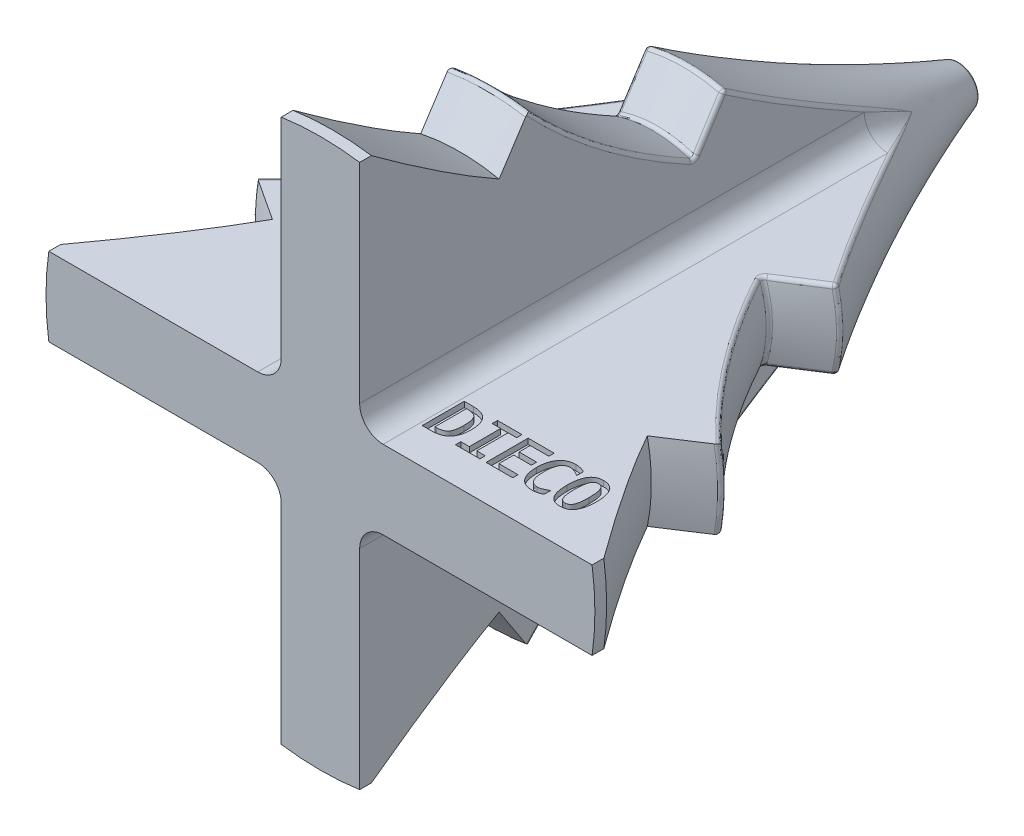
SolidWorks part; units mm, degrees
ref_plane "Alzado" through (0, 0, 0) normal (0, 0, 1) x (1, 0, 0)
ref_plane "Planta" through (0, 0, 0) normal (0, 1, 0) x (1, 0, 0)
ref_plane "Vista lateral" through (0, 0, 0) normal (1, 0, 0) x (0, 0, -1)
sketch "Croquis1" plane through (0, 0, 0) normal (0, 1, 0) x (1, 0, 0)
  line L0 (0, 0) -> (0, 80)
  line L1 (0, 0) -> (35, 0)
  line L2 (0, 80) -> (0, 45) construction
  line L3 (0, 80) -> (2.5, 80)
  line L4 (0, 45) -> (0, 20) construction
  line L10 (14.323, 41.2154) -> (20, 45)
  line L11 (24.4232, 16.2821) -> (30, 20)
  spline S0 degree 2 poles (2.5, 80) (9.2645, 61.0905) (20, 45) knots 0 0 0 0.406484 0.406484 0.406484
  spline S1 degree 3 poles (14.323, 41.2154) (18.5439, 32.9435) (23.7695, 25.8717) (30, 20) knots 0.050771 0.050771 0.050771 0.050771 0.390886 0.390886 0.390886 0.390886
  spline S2 degree 3 poles (24.4232, 16.2821) (26.9964, 11.6094) (30.522, 6.182) (35, 0) knots 0.065396 0.065396 0.065396 0.065396 0.300914 0.300914 0.300914 0.300914
  dimension "D1" = 80
  dimension "D2" = 35
  dimension "D3" = 30
  dimension "D4" = 20
  dimension "D5" = 2.5
revolve "Revolución3" add sketch "Croquis1" angle 360 about L0
sketch "Croquis4" plane through (0, 0, 0) normal (0, 0, 1) x (1, 0, 0)
  line L0 (5, 0) -> (0, 0) construction
  line L1 (0, -5) -> (0, 5) construction
  line L2 (5, -34.641) -> (5, -5)
  line L3 (34.641, 5) -> (5, 5)
  line L4 (-5, -34.641) -> (-5, -5)
  line L5 (34.641, -5) -> (5, -5)
  line L6 (-5, -42.1055) -> (-5, 58.1139) construction
  line L7 (0, -42.1055) -> (0, 58.1139) construction
  line L8 (49.5534, 5) -> (-46.4654, 5) construction
  line L9 (49.5534, 0) -> (-46.4654, 0) construction
  line L10 (49.5534, -5) -> (-46.4654, -5) construction
  line L11 (5, -42.1055) -> (5, 58.1139) construction
  line L12 (-5, 5) -> (-34.641, 5)
  line L14 (-5, 5) -> (-5, 34.641)
  line L15 (-5, -5) -> (-34.641, -5)
  line L16 (5, 5) -> (5, 34.641)
  arc A0 (-5, 34.641) -> (-34.641, 5) centre (0, 0) ccw
  arc A1 (-34.641, -5) -> (-5, -34.641) centre (0, 0) ccw
  arc A2 (5, -34.641) -> (34.641, -5) centre (0, 0) ccw
  arc A3 (34.641, 5) -> (5, 34.641) centre (0, 0) ccw
  dimension "D1" = 5
  dimension "D2" = 5
extrude "Cortar-Extruir5" cut sketch "Croquis4" against normal blind 106
fillet "Redondeo2" radius 0.5 13 edges at (5, 10.3093, -59.4433) (-5, 12.8607, -55.1172) (-10.3093, 5, -59.4433) (-12.8607, -5, -55.1172) (-5, -10.3093, -59.4433) (5, -12.8607, -55.1172) (10.3093, -5, -59.4433) (12.8607, 5, -55.1172) (0, 20, -45) (-20, 0, -45) (0, -20, -45) (20, 0, -45) (2.5, 0, -80)
sketch "Croquis5" plane through (0, 5, 0) normal (0, 1, 0) x (1, 0, 0)
  line L0 (7.9387, 3.0649) -> (36.7751, 3.0649) construction
  text T0 "<b>DIECO</b>" font "DejaVu Sans Mono" height in points 20
extrude "Cortar-Extruir6" cut sketch "Croquis5" against normal blind 0.7
fillet "Redondeo3" radius 3 8 edges at (-4.9195, 4.9195, -68.7593) (-4.9195, -4.9195, -68.7593) (4.9195, -4.9195, -68.7593) (4.9195, 4.9195, -68.7593) (-5, 5, -34.0503) (-5, -5, -34.0503) (5, -5, -34.0503) (5, 5, -34.0503)
fillet "Redondeo5" radius 0.5 32 edges at (-4.9192, 19.1756, -45.0362) (4.9192, 19.1756, -45.0362) (-19.1756, 4.9192, -45.0362) (-19.1756, -4.9192, -45.0362) (4.9192, -19.1756, -45.0362) (-4.9192, -19.1756, -45.0362) (19.1756, -4.9192, -45.0362) (19.1756, 4.9192, -45.0362) (0, 30, -20) (-5, 24.7031, -24.9831) (0, 14.323, -41.2154) (5, 17.5566, -34.3121) (-14.323, 0, -41.2154) (-17.5566, 5, -34.3121) (-30, 0, -20) (-24.7031, -5, -24.9831) (0, -30, -20) (5, -24.7031, -24.9831) (0, -14.323, -41.2154) (-5, -17.5566, -34.3121) (14.323, 0, -41.2154) (17.5566, -5, -34.3121) (30, 0, -20) (24.7031, 5, -24.9831)
sketch "Croquis6" plane through (0, 0, 0) normal (0, 0, 1) x (1, 0, 0)
  line L8 (34.641, 5) -> (8, 5)
  line L9 (5, 8) -> (5, 34.641)
  line L10 (-5, 34.641) -> (-5, 8)
  line L11 (-8, 5) -> (-34.641, 5)
  line L12 (-34.641, -5) -> (-8, -5)
  line L13 (-5, -8) -> (-5, -34.641)
  line L14 (5, -34.641) -> (5, -8)
  line L15 (8, -5) -> (34.641, -5)
  line L16 (34.641, 5) -> (8, 5)
  line L17 (5, 8) -> (5, 34.641)
  line L18 (-5, 34.641) -> (-5, 8)
  line L19 (-8, 5) -> (-34.641, 5)
  line L20 (-34.641, -5) -> (-8, -5)
  line L21 (-5, -8) -> (-5, -34.641)
  line L22 (5, -34.641) -> (5, -8)
  line L23 (8, -5) -> (34.641, -5)
  arc A8 (5, 8) -> (8, 5) centre (8, 8) ccw
  arc A9 (5, 34.641) -> (-5, 34.641) centre (0, 0) ccw
  arc A10 (-8, 5) -> (-5, 8) centre (-8, 8) ccw
  arc A11 (-34.641, 5) -> (-34.641, -5) centre (0, 0) ccw
  arc A12 (-5, -8) -> (-8, -5) centre (-8, -8) ccw
  arc A13 (-5, -34.641) -> (5, -34.641) centre (0, 0) ccw
  arc A14 (8, -5) -> (5, -8) centre (8, -8) ccw
  arc A15 (34.641, -5) -> (34.641, 5) centre (0, 0) ccw
  arc A16 (5, 8) -> (8, 5) centre (8, 8) ccw
  arc A17 (5, 34.641) -> (-5, 34.641) centre (0, 0) ccw
  arc A18 (-8, 5) -> (-5, 8) centre (-8, 8) ccw
  arc A19 (-34.641, 5) -> (-34.641, -5) centre (0, 0) ccw
  arc A20 (-5, -8) -> (-8, -5) centre (-8, -8) ccw
  arc A21 (-5, -34.641) -> (5, -34.641) centre (0, 0) ccw
  arc A22 (8, -5) -> (5, -8) centre (8, -8) ccw
  arc A23 (34.641, -5) -> (34.641, 5) centre (0, 0) ccw
  dimension "D1" = 0
extrude "Saliente-Extruir1" add sketch "Croquis6" along normal blind 1.5
